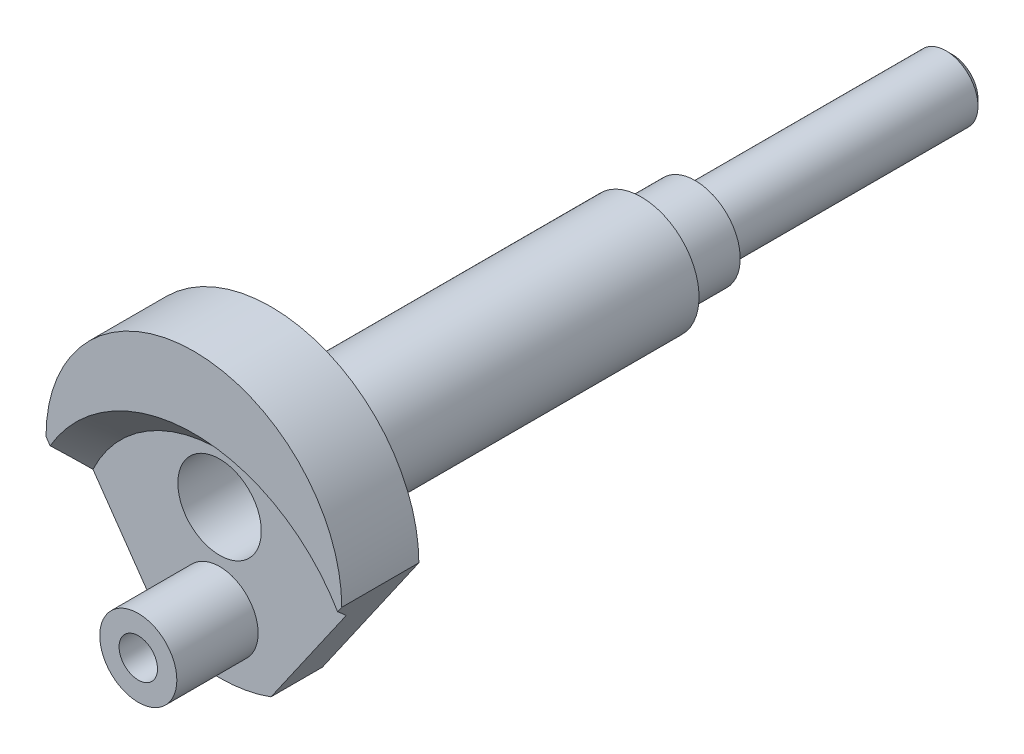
SolidWorks part; units mm, degrees
ref_plane "Front Plane" through (0, 0, 0) normal (0, 0, 1) x (1, 0, 0)
ref_plane "Top Plane" through (0, 0, 0) normal (0, 1, 0) x (1, 0, 0)
ref_plane "Right Plane" through (0, 0, 0) normal (1, 0, 0) x (0, 0, -1)
ref_plane "Plane4" through (0, 0, 0) normal (0, 0, 1) x (-1, 0, 0)
sketch "CR1" plane through (0, 0, 0) normal (0, 0, 1) x (-1, 0, 0)
  line L0 (-26.7945, 0) -> (26.7945, 0) construction
  circle A0 centre (0, 0) radius 24.3586
  dimension "D1" = 48.7172
extrude "Extrude1" add sketch "CR1" along normal blind 12.7
ref_plane "Plane5" through (0, 0, 0) normal (1, 0, 0) x (0, 0, 1)
sketch "CR2" plane through (0, 0, 0) normal (1, 0, 0) x (0, 0, 1)
  line L0 (8.4667, 14.8167) -> (8.4667, -8.2127)
  line L1 (8.4667, -8.2127) -> (12.7, -12.6153)
  line L2 (8.255, 14.8167) -> (12.9117, 14.8167) construction
  line L3 (12.7, 14.8167) -> (12.7, -12.6153)
  line L4 (8.4667, 14.8167) -> (12.7, 14.8167)
revolve "Cut-Revolve1" cut sketch "CR2" angle 360 about L2
ref_plane "Plane6" through (3.1665, -14.8167, 8.4667) normal (0, 1, 0) x (1, 0, 0)
sketch "SH3" plane through (3.1665, -14.8167, 8.4667) normal (0, 1, 0) x (1, 0, 0)
  line L0 (0, 0) -> (3.1835, 0)
  line L1 (3.1835, 0) -> (3.1835, -13.3888)
  line L2 (3.1835, -13.3888) -> (0, -13.3888)
  line L3 (0, -13.3888) -> (0, 0)
  line L4 (-3.1665, -14.0583) -> (-3.1665, 0.6694) construction
  dimension "D1" = 13.3888
revolve "Revolve1" add sketch "SH3" angle 360 about L4
ref_plane "Plane7" through (0, 0, 0) normal (0, 1, 0) x (-1, 0, 0)
sketch "SH4" plane through (0, 0, 0) normal (0, 1, 0) x (-1, 0, 0)
  line L0 (0, 0) -> (9.5165, 0)
  line L1 (9.5165, 0) -> (9.5165, -112.2172)
  line L2 (9.5165, -112.2172) -> (0, -112.2172)
  line L3 (0, -112.2172) -> (0, 0)
  line L4 (0, -117.8281) -> (0, 5.6109) construction
  dimension "D1" = 112.2172
  dimension "D2" = 9.5165
revolve "Revolve2" add sketch "SH4" angle 360 about L4
ref_plane "Plane8" through (0, 0, 0) normal (1, 0, 0) x (0, 0, 1)
sketch "NE1" plane through (0, 0, 0) normal (1, 0, 0) x (0, 0, 1)
  line L0 (-112.2172, 9.5165) -> (-112.2172, 7.4083)
  line L1 (-112.2172, 7.4083) -> (-60.9939, 7.4083)
  line L2 (-60.9939, 7.4083) -> (-60.9939, 9.5165)
  line L3 (-114.7784, 0) -> (-58.4327, 0) construction
  line L4 (-112.2172, 9.5165) -> (-60.9939, 9.5165)
  dimension "D1" = 51.2233
ref_plane "Plane9" through (0, 0, 0) normal (1, 0, 0) x (0, 0, 1)
sketch "NE2" plane through (0, 0, 0) normal (1, 0, 0) x (0, 0, 1)
  line L0 (-112.2172, 7.4083) -> (-112.2172, 5.2832)
  line L1 (-112.2172, 5.2832) -> (-69.8839, 5.2832)
  line L2 (-69.8839, 5.2832) -> (-69.8839, 7.4083)
  line L3 (-114.3339, 0) -> (-67.7672, 0) construction
  line L4 (-112.2172, 7.4083) -> (-69.8839, 7.4083)
  dimension "D1" = 42.3333
ref_plane "Plane10" through (0, 0, 8.4667) normal (0, 1, 0) x (-1, 0, 0)
sketch "HOLE1" plane through (0, 0, 8.4667) normal (0, 1, 0) x (-1, 0, 0)
  line L0 (0, 0) -> (6.8749, 0)
  line L1 (6.8749, 0) -> (6.8749, -38.1)
  line L2 (6.8749, -38.1) -> (0, -42.0692)
  line L3 (0, -42.0692) -> (0, 0)
  line L4 (0, -44.1727) -> (0, 2.1035) construction
  dimension "D1" = 6.8749
revolve "Cut-Revolve2" cut sketch "HOLE1" angle 360 about L4
ref_plane "Plane11" through (0, 0, 0) normal (0, 0, -1) x (1, 0, 0)
sketch "CUT2" plane through (0, 0, 0) normal (0, 0, -1) x (1, 0, 0)
  line L0 (8.4667, 22.8398) -> (24.3586, 0)
extrude "Cut-Extrude1" cut sketch "CUT2" against normal blind 12.8693
ref_plane "Plane12" through (0, 0, 0) normal (0, 0, 1) x (-1, 0, 0)
sketch "Sketch9" plane through (0, 0, 0) normal (0, 0, 1) x (-1, 0, 0)
  line L0 (8.4667, 22.8398) -> (24.3586, 0)
extrude "Cut-Extrude2" cut sketch "Sketch9" along normal blind 12.8693
sketch3d "Ref Origin1"
  line L0 (0, 0, 16.3576) -> (0, 0, 18.8976)
  line L1 (0, 0, 16.3576) -> (0, -2.54, 16.3576)
  point P0 (0, 0, 16.3576)
revolve "Cut-Revolve3" cut sketch "NE1" angle 360 about L3
revolve "Cut-Revolve4" cut sketch "NE2" angle 360 about L3
chamfer "Chamfer1" distance 1.0414 angle 45 1 edges at (-5.2832, 0, -112.2172)
